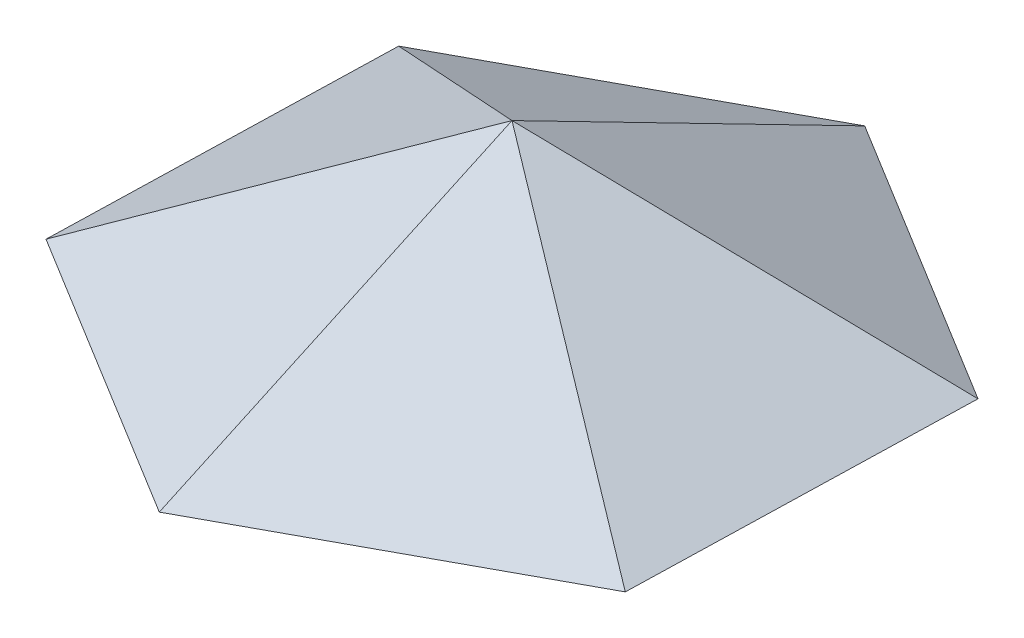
SolidWorks part; units mm, degrees
ref_plane "Alzado" through (0, 0, 0) normal (0, 0, 1) x (1, 0, 0)
ref_plane "Planta" through (0, 0, 0) normal (0, 1, 0) x (1, 0, 0)
ref_plane "Vista lateral" through (0, 0, 0) normal (1, 0, 0) x (0, 0, -1)
sketch "Croquis1" plane through (0, 0, 0) normal (0, 1, 0) x (1, 0, 0)
  line L4 (0.7956, 29.9894) -> (-25.5738, 15.6838)
  line L5 (-25.5738, 15.6838) -> (-26.3694, -14.3057)
  line L6 (-26.3694, -14.3057) -> (-0.7956, -29.9894)
  line L7 (-0.7956, -29.9894) -> (25.5738, -15.6838)
  line L8 (25.5738, -15.6838) -> (26.3694, 14.3057)
  line L9 (26.3694, 14.3057) -> (0.7956, 29.9894)
  circle A0 centre (0, 0) radius 25.9808 construction
  dimension "D1" = 30
extrude "Saliente-Extruir1" add sketch "Croquis1" along normal blind 20 draft 60
